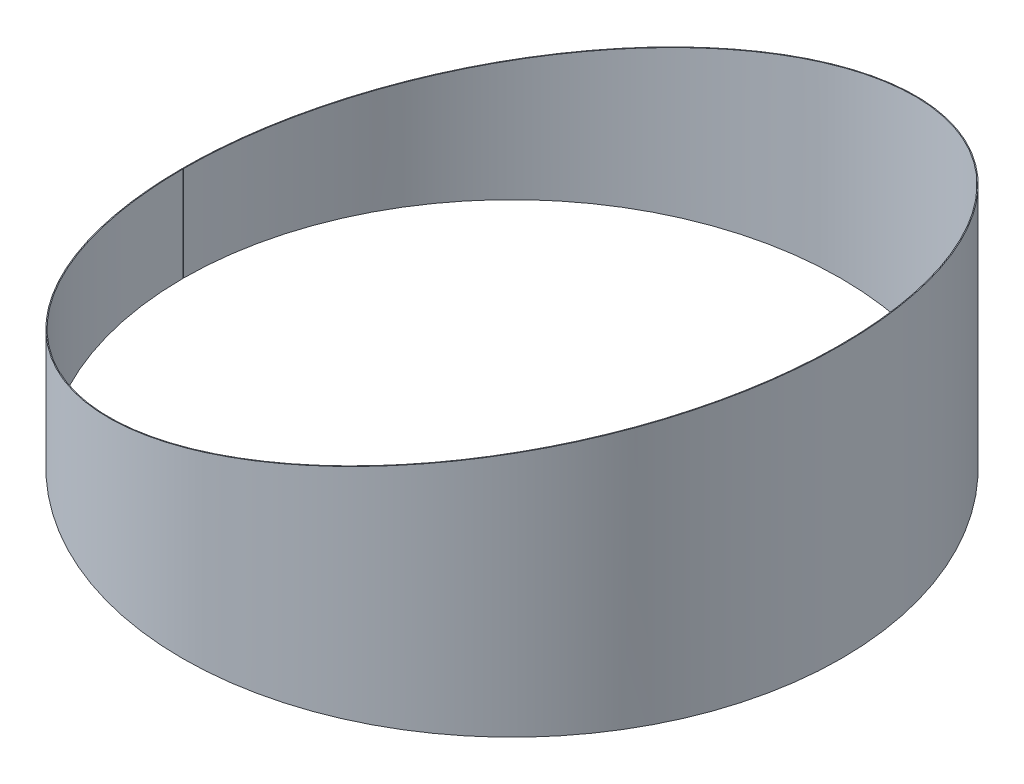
SolidWorks part; units mm, degrees
ref_plane "前视基准面" through (0, 0, 0) normal (0, 0, 1) x (1, 0, 0)
ref_plane "上视基准面" through (0, 0, 0) normal (0, 1, 0) x (1, 0, 0)
ref_plane "右视基准面" through (0, 0, 0) normal (1, 0, 0) x (0, 0, -1)
imported_body "基体零件-等径四节弯头-1"
sheet metal parameters "钣金1" parameters "D1"=0.7366, "厚度"=1
bend "圆角折弯1" bend radius 409 bend angle 359.86 parameters "D5"=1
flatten bends "展开-折弯1" parameters "D1"=0
sketch "尖角-草图1" plane through (440.0003, 58.9489, 0.5) normal (-1, 0, 0.0012) x (0.0012, 0, 1)
  line L0 (1284.4126, 58.9489) -> (1284.4126, -58.9489) construction
process bends "加工-折弯1" parameters "D1"=0
sketch "平面-草图1" plane through (440.0003, 58.9489, 0.5) normal (-1, 0, 0.0012) x (0.0012, 0, 1)
